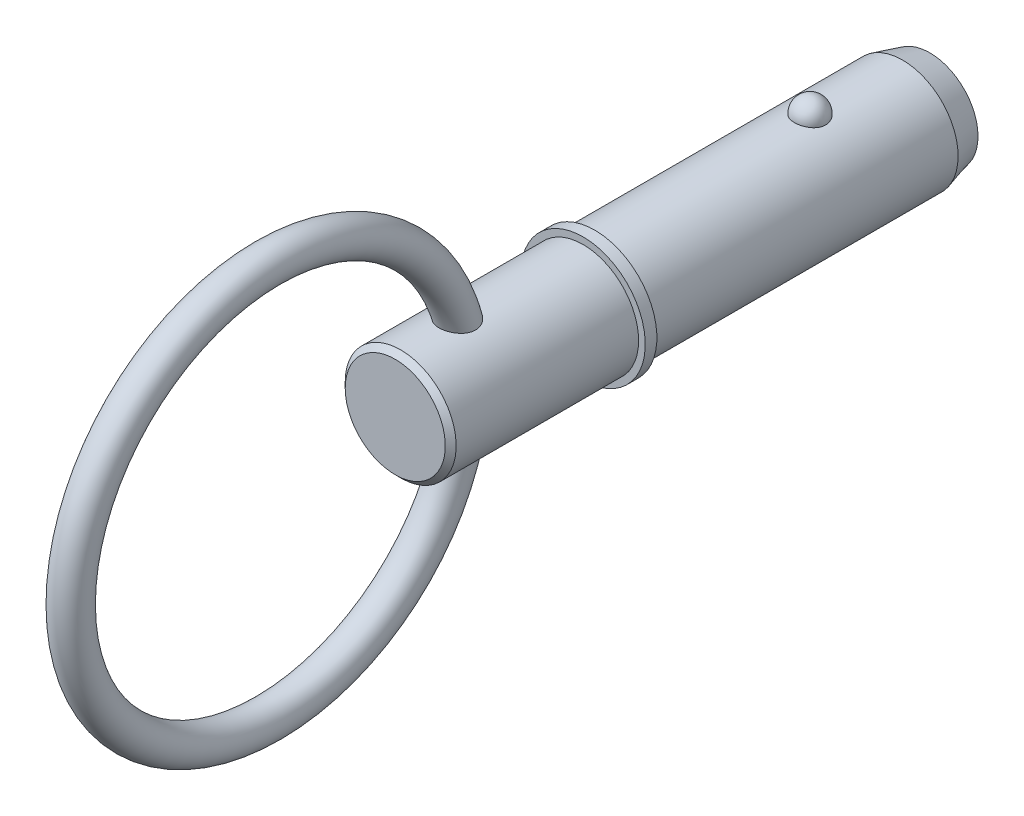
SolidWorks part; units mm, degrees
ref_plane "Front Plane" through (0, 0, 0) normal (0, 0, 1) x (1, 0, 0)
ref_plane "Top Plane" through (0, 0, 0) normal (0, 1, 0) x (1, 0, 0)
ref_plane "Right Plane" through (0, 0, 0) normal (1, 0, 0) x (0, 0, -1)
sketch "Sketch2" plane through (0, 0, 0) normal (0, 0, 1) x (1, 0, 0)
  circle A0 centre (0, 0) radius 7.145
  point P3 (0, 7.145)
  dimension "D1" = 14.29
extrude "Boss-Extrude1" add sketch "Sketch2" along normal blind 25.7
sketch "Sketch3" plane through (0, 0, 0) normal (0, 0, -1) x (-1, 0, 0)
  circle A0 centre (0, 0) radius 7.145
  dimension "D1" = 14.29
extrude "Boss-Extrude2" add sketch "Sketch3" along normal blind 17.45
chamfer "Chamfer1" distance 3.5 angle 15 1 edges at (-7.145, 0, -17.45)
sketch "Sketch18" plane through (0, 0, 0) normal (1, 0, 0) x (0, 0, -1)
  line L0 (13.95, 7.145) -> (-25.7, 7.145) construction
  line L1 (2.02, 9.165) -> (2.02, 5.125)
  line L2 (-25.7, -7.145) -> (13.95, -7.145) construction
  arc A0 (2.02, 9.165) -> (2.02, 5.125) centre (2.02, 7.145) ccw
  point P4 (0, 7.145)
  dimension "D1" = 16.31
revolve "Revolve1" add sketch "Sketch18" angle 360 about L1
sketch "Sketch19" plane through (0, 0, 0) normal (1, 0, 0) x (0, 0, -1)
  line L0 (-33.7288, 0) -> (-46.4542, 0) construction
sketch "Sketch20" plane through (0, 0, 0) normal (1, 0, 0) x (0, 0, -1)
  line L0 (-25.7, 0) -> (-25.7, 8)
  line L1 (-25.7, 7.145) -> (-25.7, -7.145) construction
  line L2 (-25.7, 8) -> (-27.2, 8)
  line L3 (-27.2, 8) -> (-27.2, 0)
  line L4 (-33.7288, 0) -> (-46.4542, 0) construction
  line L5 (-27.2, 0) -> (-25.7, 0)
  dimension "D1" = 8
  dimension "D2" = 1.5
revolve "Revolve2" add sketch "Sketch20" angle 360 about L0
sketch "Sketch21" plane through (0, 0, 25.7) normal (0, 0, -1) x (-1, 0, 0)
  circle A0 centre (0, 0) radius 7.145
  dimension "D1" = 14.29
extrude "Boss-Extrude3" add sketch "Sketch21" against normal blind 25.7
chamfer "Chamfer2" distance 0.7 angle 45 1 edges at (-7.145, 0, 51.4)
sketch "Sketch23" plane through (0, 0, 0) normal (1, 0, 0) x (0, 0, -1)
  line L0 (-51.4, 6.445) -> (-51.4, -6.445) construction
  circle A0 centre (-67.8, 0) radius 25.4
  point P2 (-42.4, 0)
  dimension "D1" = 50.8
  dimension "D2" = 9
sketch "Sketch24" plane through (0, 0, 0) normal (0, 1, 0) x (1, 0, 0)
  circle A0 centre (0, -42.4) radius 2.25
  dimension "D1" = 4.5
sweep "Sweep1" add profiles "Sketch24" path "Sketch23"
